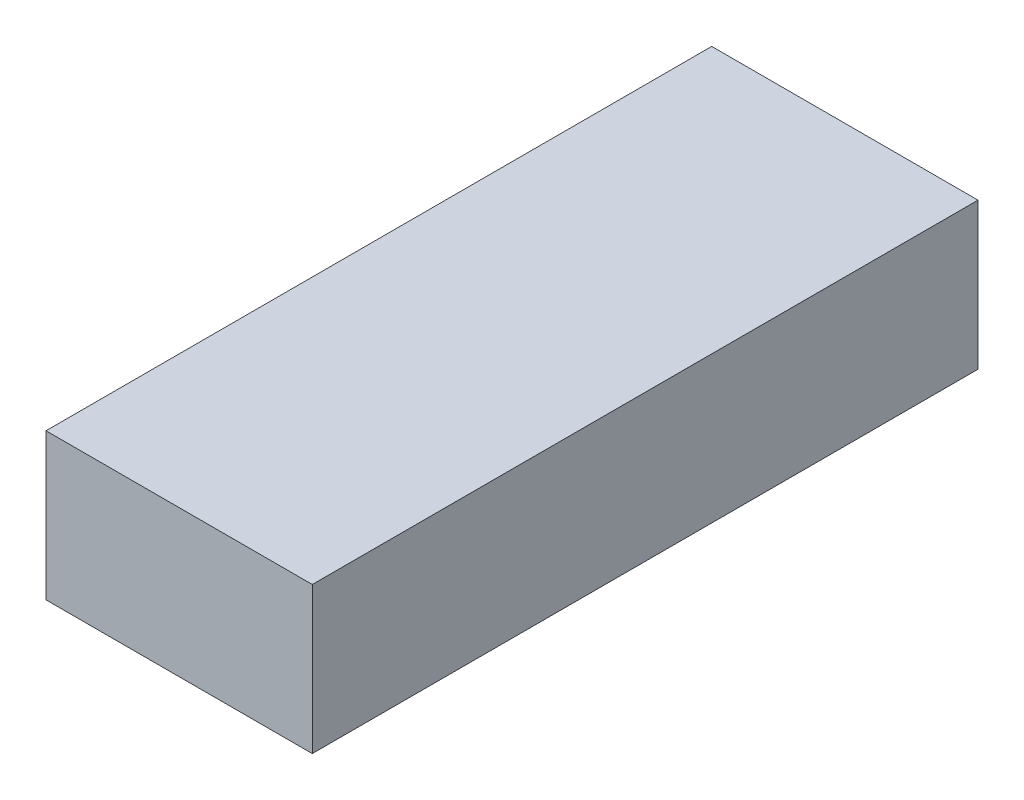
SolidWorks part; units mm, degrees
ref_plane "Front Plane" through (0, 0, 0) normal (0, 0, 1) x (1, 0, 0)
ref_plane "Top Plane" through (0, 0, 0) normal (0, 1, 0) x (1, 0, 0)
ref_plane "Right Plane" through (0, 0, 0) normal (1, 0, 0) x (0, 0, -1)
sketch "Sketch1" plane through (0, 0, 0) normal (0, 0, 1) x (1, 0, 0)
  line L1 (0, 0) -> (20, 0)
  line L2 (0, 0) -> (0, 11)
  line L3 (0, 11) -> (20, 11)
  line L4 (20, 0) -> (20, 11)
  dimension "D1" = 11
  dimension "D2" = 20
extrude "Boss-Extrude1" add sketch "Sketch1" along normal blind 50
